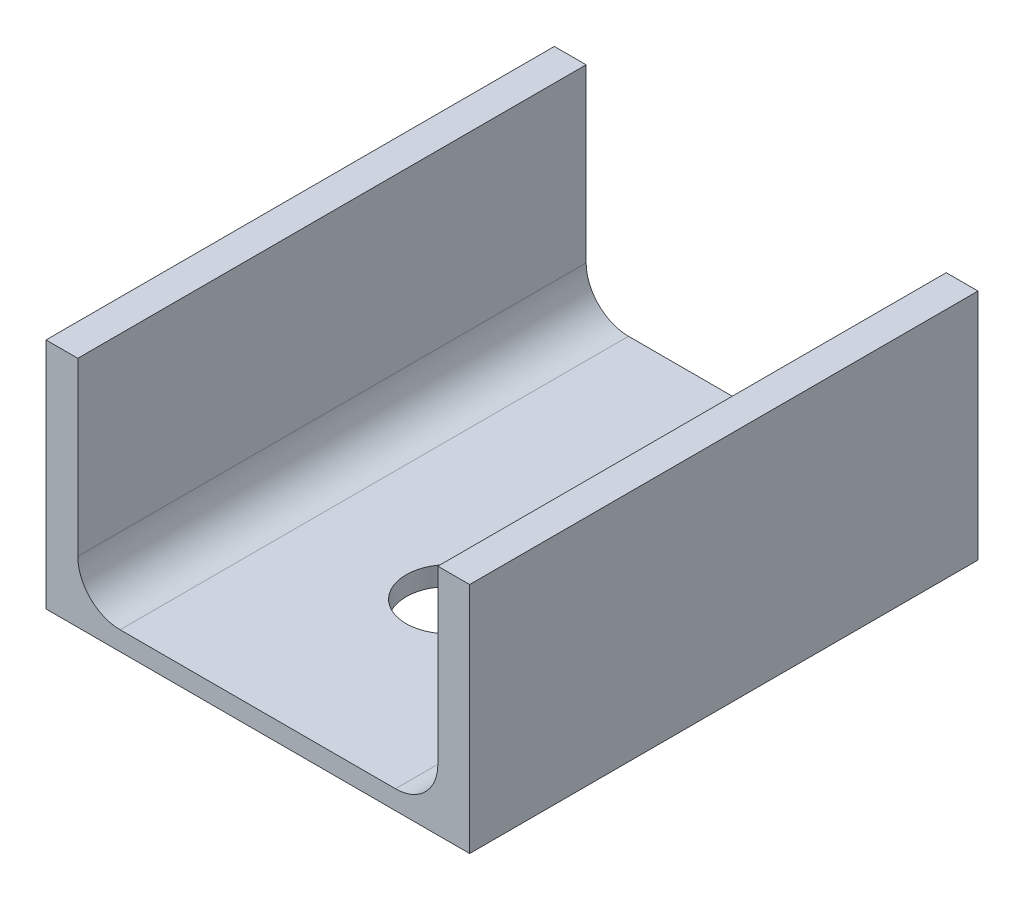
SolidWorks part; units mm, degrees
ref_plane "Plan de face" through (0, 0, 0) normal (0, 0, 1) x (1, 0, 0)
ref_plane "Plan de dessus" through (0, 0, 0) normal (0, 1, 0) x (1, 0, 0)
ref_plane "Plan de droite" through (0, 0, 0) normal (1, 0, 0) x (0, 0, -1)
sketch "Esquisse1" plane through (0, 0, 0) normal (0, 0, 1) x (1, 0, 0)
  line L0 (0, 0) -> (100, 0)
  line L1 (100, 0) -> (100, 55)
  line L2 (100, 55) -> (92.5, 55)
  line L3 (92.5, 55) -> (92.5, 14.5)
  line L4 (82.5, 4.5) -> (17.5, 4.5)
  line L5 (7.5, 14.5) -> (7.5, 55)
  line L6 (0, 0) -> (0, 55)
  line L7 (0, 55) -> (7.5, 55)
  arc A0 (17.5, 4.5) -> (7.5, 14.5) centre (17.5, 14.5) cw
  arc A1 (92.5, 14.5) -> (82.5, 4.5) centre (82.5, 14.5) cw
  dimension "D7" = 10
  dimension "D1" = 100
  dimension "D2" = 55
  dimension "D3" = 7.5
  dimension "D4" = 7.5
  dimension "D5" = 4.5
  dimension "D6" = 55
extrude "Extrusion1" add sketch "Esquisse1" along normal blind 120 contours L1 L2 L3 A1 L4 A0 L5 L7 L6 L0
sketch "Esquisse2" plane through (0, 4.5, 0) normal (0, 1, 0) x (-1, 0, 0)
  line L0 (0, 120) -> (0, 0) construction
  line L2 (-82.5, 0) -> (-17.5, 0) construction
  circle A0 centre (-50, 75) radius 10
  circle A1 centre (-50, 20) radius 5
  dimension "D1" = 50
  dimension "D2" = 50
  dimension "D4" = 20
  dimension "D3" = 55
extrude "Enlèv. mat.-Extru.1" cut sketch "Esquisse2" against normal blind 10
